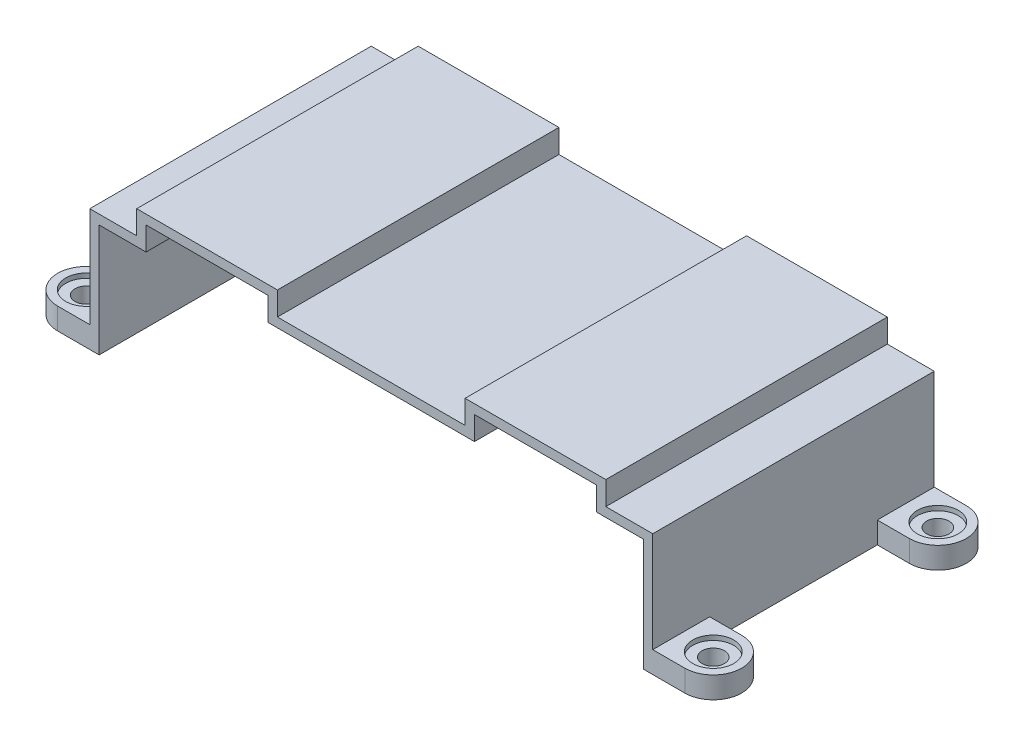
SolidWorks part; units mm, degrees
ref_plane "Front Plane" through (0, 0, 0) normal (0, 0, 1) x (1, 0, 0)
ref_plane "Top Plane" through (0, 0, 0) normal (0, 1, 0) x (1, 0, 0)
ref_plane "Right Plane" through (0, 0, 0) normal (1, 0, 0) x (0, 0, -1)
sketch "Sketch1"
  dimension "D1" = 76.2
  dimension "D2" = 25.4
  dimension "D3" = 12.7
  dimension "D6" = 2.54
extrude "Extrude1" add sketch "Sketch1" along normal blind 76.2
sketch "Sketch2"
extrude "Extrude2" add sketch "Sketch2" against normal blind 5.842
sketch "Sketch3"
extrude "Extrude3" cut sketch "Sketch3" against normal blind 1.27
hole_wizard "B (0.238) Diameter Hole1" positions "3DSketch1" profile "Sketch6" hole size "B" standard "Ansi Inch"
sketch3d "3DSketch1"
sketch "Sketch6"
  dimension "Thru Hole Dia." = 6.0452
  dimension "Thru Hole Depth" = 4.5721
mirror "Mirror1" of "B (0.238) Diameter Hole1", "Extrude2", "Extrude3"
ref_plane "Plane2" through (0, 0, 38.1) normal (0, 0, 1) x (1, 0, 0)
mirror "Mirror2" of "B (0.238) Diameter Hole1", "Extrude2", "Extrude3", "Mirror1"
